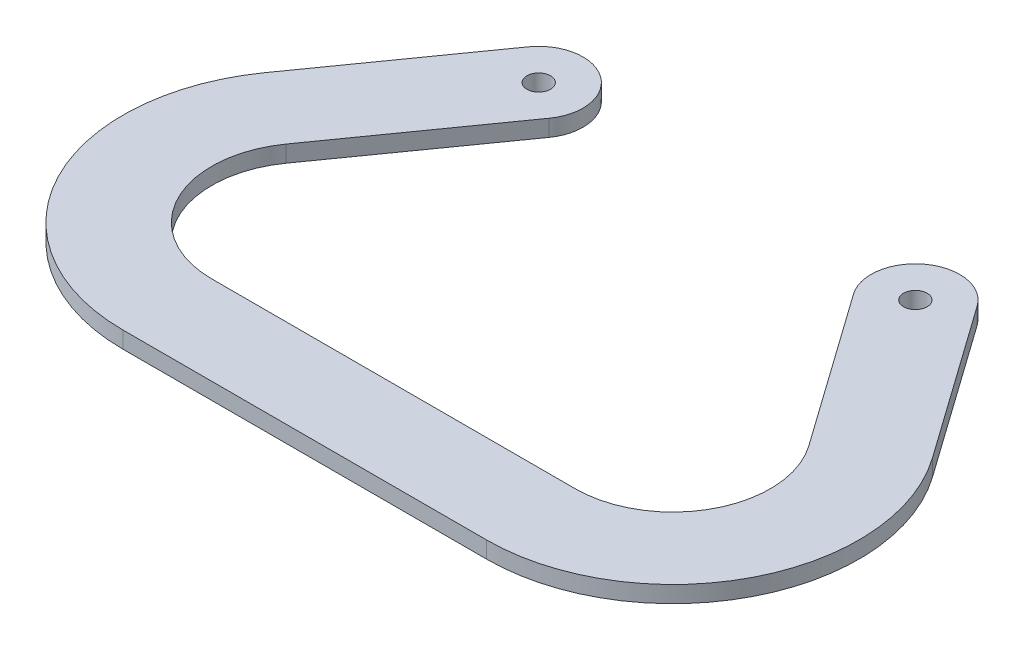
SolidWorks part; units mm, degrees
ref_plane "Front Plane" through (0, 0, 0) normal (0, 0, 1) x (1, 0, 0)
ref_plane "Top Plane" through (0, 0, 0) normal (0, 1, 0) x (1, 0, 0)
ref_plane "Right Plane" through (0, 0, 0) normal (1, 0, 0) x (0, 0, -1)
sketch "Sketch1" plane through (0, 0, 0) normal (0, 1, 0) x (1, 0, 0)
  line L0 (0, 0) -> (0, -30.7524) construction
  line L1 (-74.8577, 16.1668) -> (-43.5874, 60.2434)
  line L2 (-64.3035, 74.9405) -> (-95.5738, 30.8639)
  line L4 (64.3035, 74.9405) -> (95.5738, 30.8639)
  line L6 (52.07, -53.34) -> (-52.07, -53.34)
  line L7 (0, 0) -> (0, 88.8351) construction
  line L13 (74.8577, 16.1668) -> (43.5874, 60.2434)
  line L16 (-52.07, -27.94) -> (52.07, -27.94)
  line L17 (53.9455, 67.5919) -> (101.9973, -0.1389) construction
  arc A0 (64.3035, 74.9405) -> (43.5874, 60.2434) centre (53.9455, 67.5919) ccw
  arc A1 (52.07, -53.34) -> (95.5738, 30.8639) centre (52.07, 0) ccw
  arc A2 (-52.07, -27.94) -> (-74.8577, 16.1668) centre (-52.07, 0) cw
  arc A3 (-52.07, -53.34) -> (-95.5738, 30.8639) centre (-52.07, 0) cw
  arc A4 (-64.3035, 74.9405) -> (-43.5874, 60.2434) centre (-53.9455, 67.5919) cw
  arc A7 (11.43, -30.48) -> (17.0744, 36.8232) centre (52.07, 0) ccw construction
  arc A13 (52.07, -27.94) -> (74.8577, 16.1668) centre (52.07, 0) ccw
  point P11 (0, -53.34)
  point P12 (155.3125, -53.34)
  point P17 (0, -15.1822)
  point P31 (0, -27.94)
  dimension "D3" = 25.4
  dimension "D2" = 25.4
  dimension "D1" = 2.54
extrude "Boss-Extrude1" add sketch "Sketch1" along normal blind 4.7625
hole_wizard "17/64 (0.26563) Diameter Hole2" positions "Sketch3" profile "Sketch2" hole size "17/64" standard "ANSI Inch"
sketch "Sketch3" plane through (0, 4.7625, 0) normal (0, 1, 0) x (1, 0, 0)
  circle A0 centre (-53.9455, 67.5919) radius 2.0193 construction
  circle A1 centre (53.9455, 67.5919) radius 2.4574 construction
  point P0 (-53.9455, 67.5919)
  point P2 (53.9455, 67.5919)
sketch "Sketch2" plane through (-53.9455, 4.7625, -67.5919) normal (1, 0, 0) x (0, 0, 1)
  line L0 (0, 0) -> (0, 4.7625)
  line L1 (0, 4.7625) -> (3.3735, 4.7625)
  line L2 (3.3735, 4.7625) -> (3.3735, 0)
  line L5 (3.3735, 0) -> (0, 0)
  line L11 (0, -6.35) -> (0, 107.95) construction
  dimension "Thru Hole Dia." = 6.747
  dimension "Thru Hole Depth" = 4.7625
